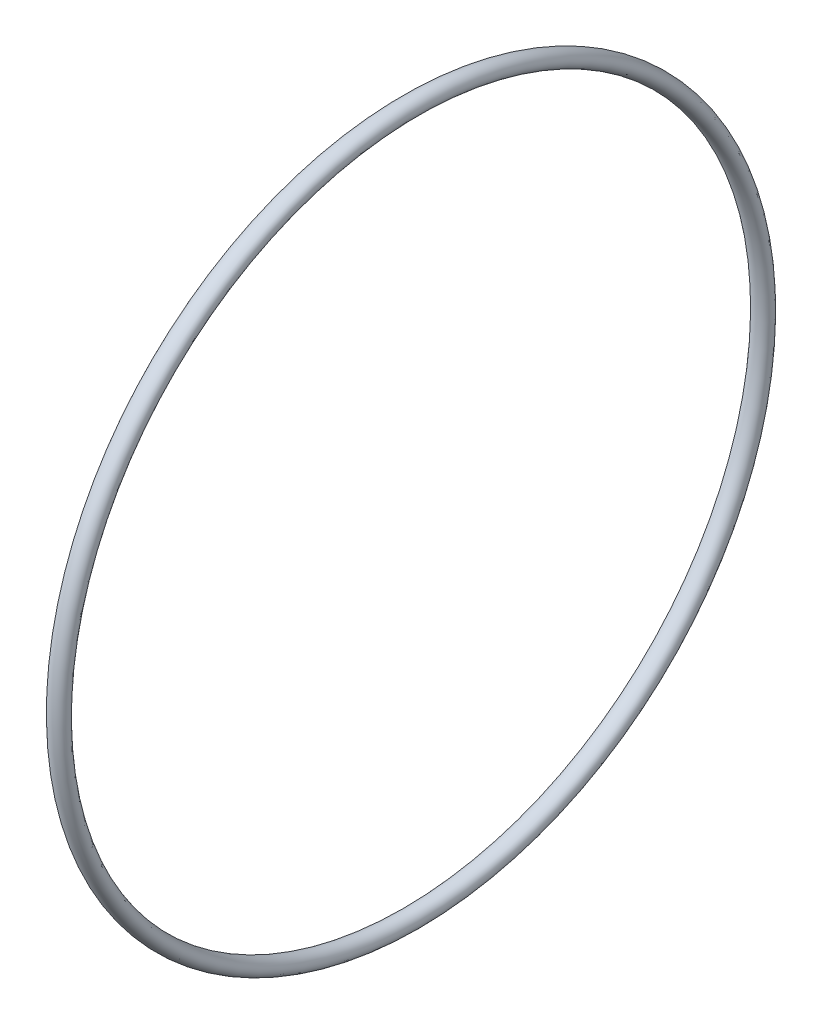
SolidWorks part; units mm, degrees
ref_plane "Plan de face" through (0, 0, 0) normal (0, 0, 1) x (1, 0, 0)
ref_plane "Plan de dessus" through (0, 0, 0) normal (0, 1, 0) x (1, 0, 0)
ref_plane "Plan de droite" through (0, 0, 0) normal (1, 0, 0) x (0, 0, -1)
sketch "Esquisse1" plane through (0, 0, 0) normal (0, 0, 1) x (1, 0, 0)
  line L0 (-22.476, 0) -> (17.816, 0) construction
  line L1 (0, 72.316) -> (0, -44.3678) construction
  ellipse E1 centre (0, 92.9) end of major axis (-2.6, 92.9) minor radius 2.05
  dimension "D1" = 5.2
  dimension "D2" = 4.1
  dimension "D3" = 92.9
revolve "Révolution1" add sketch "Esquisse1" angle 360 about L0
